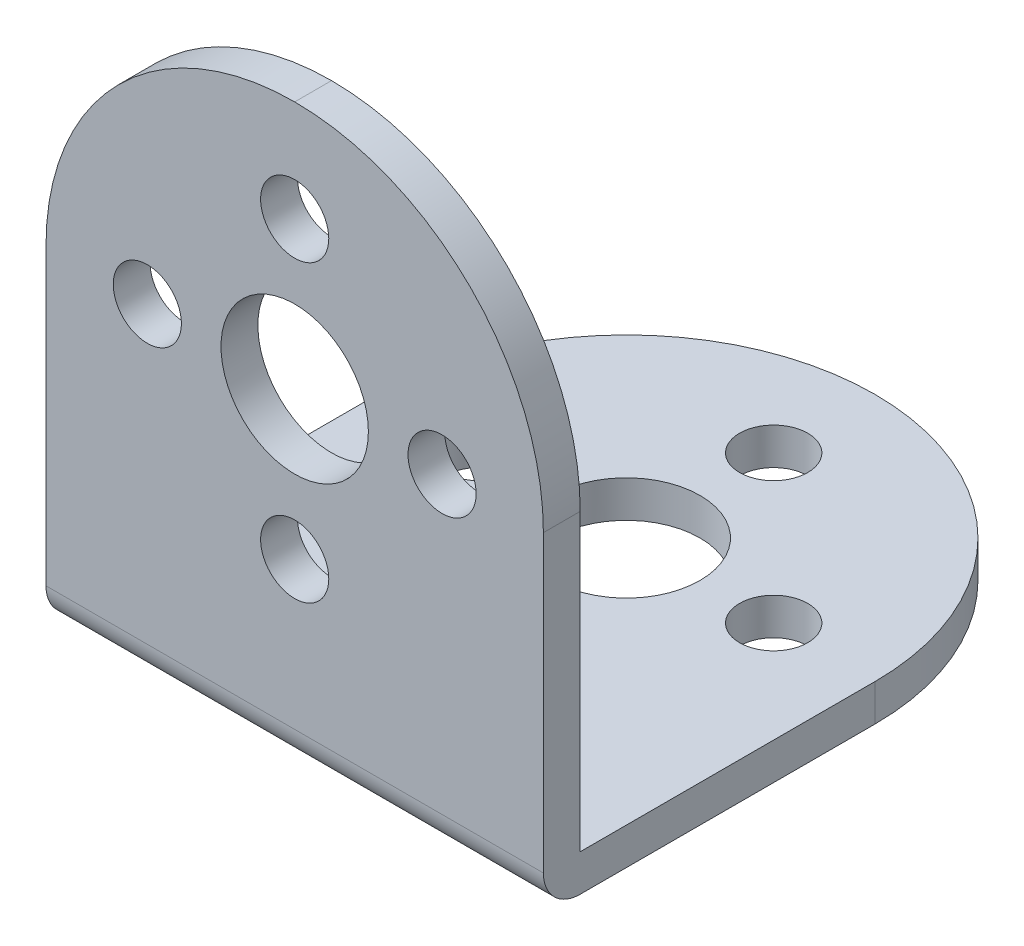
SolidWorks part; units mm, degrees
ref_plane "Front Plane" through (0, 0, 0) normal (0, 0, 1) x (1, 0, 0)
ref_plane "Top Plane" through (0, 0, 0) normal (0, 1, 0) x (1, 0, 0)
ref_plane "Right Plane" through (0, 0, 0) normal (1, 0, 0) x (0, 0, -1)
sketch "Sketch1" plane through (0, 0, 0) normal (1, 0, 0) x (0, 0, -1)
  line L0 (0, 0) -> (31.5, 0)
  line L1 (31.5, 0) -> (31.5, 2)
  line L2 (31.5, 2) -> (2, 2)
  line L3 (2, 2) -> (2, 31.5)
  line L4 (2, 31.5) -> (0, 31.5)
  line L5 (0, 31.5) -> (0, 0)
  dimension "D1" = 2
  dimension "D2" = 2
  dimension "D3" = 31.5
  dimension "D4" = 31.5
extrude "Extrude1" add sketch "Sketch1" against normal blind 27
sketch "Sketch3" plane through (0, 0, 0) normal (0, 0, 1) x (1, 0, 0)
  line L0 (-27, 31.5) -> (-27, 0) construction
  line L1 (-27, 0) -> (0, 0) construction
  dimension "D1" = 13.5
  dimension "D2" = 18
sketch_block_instance "Block4-1"
sketch_block "Block4"
extrude "Cut-Extrude1" cut sketch "Sketch3" against normal through all
sketch "Sketch4" plane through (0, 0, 0) normal (0, -1, 0) x (1, 0, 0)
  line L1 (-27, 0) -> (-27, -31.5) construction
  line L2 (-27, 0) -> (0, 0) construction
  dimension "D1" = 18
  dimension "D2" = 13.5
sketch_block_instance "Block4-2"
extrude "Cut-Extrude2" cut sketch "Sketch4" against normal through all
fillet "Fillet1" radius 13.5 1 edges at (0, 31.5, -1)
fillet "Fillet2" radius 13.5 1 edges at (-27, 31.5, -1)
fillet "Fillet3" radius 13.5 1 edges at (0, 1, -31.5)
fillet "Fillet4" radius 13.5 1 edges at (-27, 1, -31.5)
fillet "Fillet5" radius 2 1 edges at (-13.5, 0, 0)
